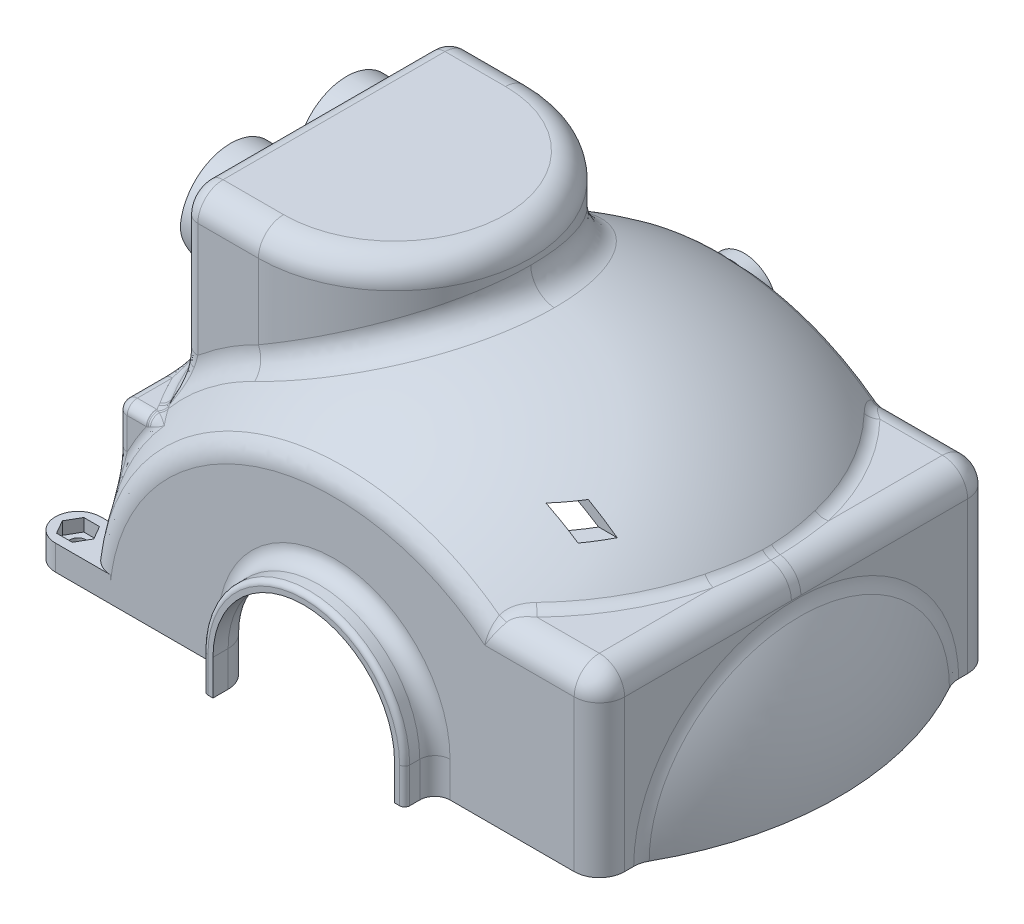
SolidWorks part; units mm, degrees
ref_plane "Plan de face" through (0, 0, 0) normal (0, 0, 1) x (1, 0, 0)
ref_plane "Plan de dessus" through (0, 0, 0) normal (0, 1, 0) x (1, 0, 0)
ref_plane "Plan de droite" through (0, 0, 0) normal (1, 0, 0) x (0, 0, -1)
sketch "Base" plane through (0, 0, 0) normal (0, 1, 0) x (1, 0, 0)
  line L0 (-52.1999, -39) -> (-25.6999, -39) construction
  line L1 (73.5868, 0) -> (-73.5868, 0) construction
  line L2 (-56.0925, -28.4341) -> (-46.1999, -20) construction
  line L3 (-19.6999, -33) -> (-19.6999, -29) construction
  line L4 (-19.6999, -29) -> (-13.8999, -29) construction
  line L5 (-9.8999, -25) -> (-9.8999, -24.5) construction
  line L6 (-9.8999, -24.5) -> (24.1001, -24.5) construction
  line L7 (24.1001, -24.5) -> (24.1001, -25) construction
  line L8 (28.1001, -29) -> (33.9001, -29) construction
  line L9 (33.9001, -29) -> (33.9001, -34) construction
  line L10 (38.9001, -39) -> (55.4001, -39) construction
  line L11 (60.4001, -34) -> (60.4001, -13.75) construction
  line L12 (57.9001, -11.25) -> (57.4001, -11.25) construction
  line L13 (57.9001, 11.25) -> (57.4001, 11.25) construction
  line L14 (60.4001, 34) -> (60.4001, 13.75) construction
  line L15 (38.9001, 39) -> (55.4001, 39) construction
  line L16 (33.9001, 29) -> (33.9001, 34) construction
  line L17 (28.1001, 29) -> (33.9001, 29) construction
  line L18 (24.1001, 24.5) -> (24.1001, 25) construction
  line L19 (-9.8999, 24.5) -> (24.1001, 24.5) construction
  line L20 (-9.8999, 25) -> (-9.8999, 24.5) construction
  line L21 (-19.6999, 29) -> (-13.8999, 29) construction
  line L22 (-19.6999, 33) -> (-19.6999, 29) construction
  line L23 (-56.0925, 28.4341) -> (-46.1999, 20) construction
  line L24 (-52.1999, 39) -> (-25.6999, 39) construction
  line L25 (57.4001, -11.25) -> (57.4001, 11.25) construction
  line L26 (-46.1999, -20) -> (-46.1999, 20) construction
  line L27 (57.4001, -66.5167) -> (57.4001, 25) construction
  line L28 (-46.1999, -66.5167) -> (-46.1999, 22.9924) construction
  line L29 (7.8001, -55.2275) -> (7.8001, 8.1549) construction
  line L30 (85.3932, 29) -> (-66.316, 29) construction
  line L31 (85.3932, -29) -> (-62.5031, -29) construction
  line L32 (39.9001, -34.5) -> (54.4001, -34.5) construction
  line L33 (-47.4499, -34.5) -> (-8.4415, -34.5) construction
  line L34 (-47.4499, 34.5) -> (-5.5388, 34.5) construction
  line L35 (-25.6999, -35.6222) -> (-25.6999, 43.8871) construction
  arc A0 (-56.0925, -28.4341) -> (-52.1999, -39) centre (-52.1999, -33) ccw construction
  arc A1 (60.4001, 13.75) -> (57.9001, 11.25) centre (57.9001, 13.75) cw construction
  arc A2 (-25.6999, -39) -> (-19.6999, -33) centre (-25.6999, -33) ccw construction
  arc A3 (-13.8999, -29) -> (-9.8999, -25) centre (-13.8999, -25) ccw construction
  arc A4 (24.1001, -25) -> (28.1001, -29) centre (28.1001, -25) ccw construction
  arc A5 (33.9001, -34) -> (38.9001, -39) centre (38.9001, -34) ccw construction
  arc A6 (55.4001, -39) -> (60.4001, -34) centre (55.4001, -34) ccw construction
  arc A7 (60.4001, -13.75) -> (57.9001, -11.25) centre (57.9001, -13.75) ccw construction
  arc A8 (38.9001, -39) -> (33.9001, -34) centre (38.9001, -34) cw construction
  arc A9 (55.4001, 39) -> (60.4001, 34) centre (55.4001, 34) cw construction
  arc A10 (24.1001, 25) -> (28.1001, 29) centre (28.1001, 25) cw construction
  arc A11 (-13.8999, 29) -> (-9.8999, 25) centre (-13.8999, 25) cw construction
  arc A12 (-25.6999, 39) -> (-19.6999, 33) centre (-25.6999, 33) cw construction
  arc A13 (-56.0925, 28.4341) -> (-52.1999, 39) centre (-52.1999, 33) cw construction
  circle A14 centre (-47.4499, -34.5) radius 1.6 construction
  circle A15 centre (-40.1999, -34.5) radius 1.6 construction
  circle A16 centre (-32.9499, -34.5) radius 1.6 construction
  circle A17 centre (-25.6999, -34.5) radius 1.6 construction
  circle A18 centre (-52.4499, -29.25) radius 1.6 construction
  circle A19 centre (-47.9499, -25.5) radius 1.6 construction
  circle A20 centre (39.9001, -34.5) radius 1.6 construction
  circle A21 centre (47.1501, -34.5) radius 1.6 construction
  circle A22 centre (54.4001, -34.5) radius 1.6 construction
  arc A23 (33.9001, 34) -> (38.9001, 39) centre (38.9001, 34) cw construction
  circle A24 centre (54.4001, 34.5) radius 1.6 construction
  circle A25 centre (47.1501, 34.5) radius 1.6 construction
  circle A26 centre (39.9001, 34.5) radius 1.6 construction
  circle A27 centre (-25.6999, 34.5) radius 1.6 construction
  circle A29 centre (-32.9499, 34.5) radius 1.6 construction
  circle A30 centre (-40.1999, 34.5) radius 1.6 construction
  circle A31 centre (-47.4499, 34.5) radius 1.6 construction
  circle A32 centre (-52.4499, 29.25) radius 1.6 construction
  circle A33 centre (-47.9499, 25.5) radius 1.6 construction
  circle A34 centre (7.8001, 0) radius 59 construction
  circle A35 centre (7.8001, 0) radius 61 construction
  dimension "D3" = 58
  dimension "D5" = 5.5
  dimension "D6" = 5
  dimension "D7" = 5.5
  dimension "D1" = 103.6
  dimension "D2" = 54
  dimension "D4" = 29
ref_plane "Plan1" through (0, 0, 0) normal (0, 0, 1) x (1, 0, 0)
sketch "Esquisse3" plane through (0, 0, 0) normal (0, 0, 1) x (1, 0, 0)
  line L0 (7.8001, -22.9267) -> (7.8001, 78.4642) construction
  line L1 (-76.3494, 0) -> (71.051, 0) construction
  line L2 (68.8001, -22.9267) -> (68.8001, 68.62) construction
  line L4 (73.5868, 0) -> (-73.5868, 0) construction
  line L5 (-76.3494, 56) -> (34.0829, 56) construction
  line L7 (7.8001, 56) -> (7.8001, 0)
  line L8 (7.8001, 0) -> (68.8001, 0)
  ellipse E0 centre (7.8001, 0) end of major axis (68.8001, 0) minor radius 56 (68.8001, 0) -> (7.8001, 56) ccw
  dimension "D1" = 61
  dimension "D2" = 56
revolve "Révolution2" add sketch "Esquisse3" angle 360 about L0
sketch "Esquisse5" plane through (0, 0, 0) normal (0, 1, 0) x (1, 0, 0)
  line L0 (7.8001, -83.8661) -> (7.8001, 13.5538) construction
  line L1 (-34.1999, -83.8661) -> (-34.1999, 57.2795) construction
  line L2 (-41.8219, -27) -> (18.8957, -27) construction
  line L3 (-82.8289, 0) -> (35.8875, 0) construction
  line L4 (73.5868, 0) -> (-73.5868, 0) construction
  line L5 (-29.1999, -73.2179) -> (-29.1999, 31.6785) construction
  line L6 (-19.1999, 27) -> (-34.1999, 27)
  line L7 (-19.1999, 37.4038) -> (-19.1999, -37.2426) construction
  line L8 (-19.1999, -27) -> (-34.1999, -27)
  line L10 (-34.1999, 27) -> (-34.1999, -27)
  arc A0 (-19.1999, -27) -> (-19.1999, 27) centre (-19.1999, 0) ccw
  dimension "D1" = 42
  dimension "D2" = 27
  dimension "D3" = 5
extrude "Boss.-Extru.2" add sketch "Esquisse5" along normal blind 67
sketch "Esquisse6" plane through (0, 0, 0) normal (0, 1, 0) x (1, 0, 0)
  line L0 (72.3863, -39) -> (30.8766, -39) construction
  line L1 (70.9993, 39) -> (29.2915, 39) construction
  line L2 (81.0853, 29) -> (16.4096, 29) construction
  line L3 (85.3932, 29) -> (-66.316, 29) construction
  line L4 (81.0853, 31) -> (16.4096, 31) construction
  line L5 (60.4001, -45.401) -> (60.4001, 49.3084) construction
  line L8 (33.9001, 39) -> (55.4089, 39)
  line L9 (33.9001, 39) -> (33.9001, -39)
  line L10 (33.9001, -39) -> (55.4089, -39)
  line L11 (60.4089, 34) -> (60.4089, -34)
  arc A0 (55.4089, 39) -> (60.4089, 34) centre (55.4089, 34) cw
  arc A1 (55.4089, -39) -> (60.4089, -34) centre (55.4089, -34) ccw
  point P26 (60.4089, -39)
  dimension "D2" = 5
  dimension "D1" = 2
extrude "Boss.-Extru.3" add sketch "Esquisse6" along normal blind 35
sketch "Esquisse7" plane through (0, 0, 0) normal (0, 1, 0) x (1, 0, 0)
  line L2 (-63.3935, -39) -> (69.5123, -39) construction
  line L3 (69.5123, -45) -> (-63.3935, -45) construction
  line L4 (7.8001, -68.0931) -> (7.8001, 0) construction
  line L6 (-12.1999, -68.0931) -> (-12.1999, -34.0884) construction
  line L7 (-12.1999, -39) -> (-12.1999, -45)
  line L8 (27.8001, -39) -> (27.8001, -45)
  line L9 (27.8001, -45) -> (-12.1999, -45)
  line L10 (27.8001, -39) -> (54.7043, -39)
  line L11 (-12.1999, -39) -> (-39.104, -39)
  line L12 (70.5045, 0) -> (-19.9845, 0) construction
  line L13 (73.5868, 0) -> (-73.5868, 0) construction
  line L14 (27.8001, 39) -> (54.7043, 39)
  line L15 (-12.1999, 39) -> (-39.104, 39)
  line L16 (27.8001, 45) -> (-12.1999, 45)
  line L17 (-12.1999, 39) -> (-12.1999, 45)
  line L18 (27.8001, 39) -> (27.8001, 45)
  arc A0 (-39.104, -39) -> (54.7043, -39) centre (7.8001, 0) ccw
  arc A1 (-39.104, 39) -> (54.7043, 39) centre (7.8001, 0) cw
  dimension "D1" = 6
  dimension "D2" = 20
extrude "Enlèv. mat.-Extru.1" cut sketch "Esquisse7" along normal blind 45
sketch "Esquisse8" plane through (0, 0, -45) normal (0, 0, -1) x (-1, 0, 0)
  line L2 (23.2692, 7) -> (-56.8001, 7) construction
  line L3 (-7.8001, -8.7668) -> (-7.8001, 31.5536) construction
  line L4 (12.1999, 7) -> (12.1999, 38.9488)
  line L5 (-27.8001, 7) -> (-27.8001, 38.9488)
  arc A0 (12.1999, 7) -> (-27.8001, 7) centre (-7.8001, 7) ccw
  arc A1 (12.1999, 38.9488) -> (-27.8001, 38.9488) centre (-7.8001, -4.9407) ccw
extrude "Enlèv. mat.-Extru.2" cut sketch "Esquisse8" against normal blind 6
mirror "Symétrie1" about plane through (0, 0, 0) normal (0, 0, 1) of "Enlèv. mat.-Extru.2"
sketch "Esquisse19" plane through (-34.1999, 0, 0) normal (-1, 0, 0) x (0, 0, 1)
  line L0 (78.7287, 0) -> (-58.759, 0) construction
  line L1 (35.6222, 0) -> (-43.8871, 0) construction
  line L2 (0, -16.6082) -> (0, 75.8696) construction
  line L3 (78.7287, 29) -> (-58.759, 29) construction
  line L4 (32, -16.6082) -> (32, 29.6307) construction
  line L5 (-32, -16.6082) -> (-32, 49.1402) construction
  line L6 (61, 0) -> (-61, 0) construction
  line L8 (-32, 0) -> (32, 0)
  line L9 (-32, 0) -> (-32, 29)
  line L10 (-32, 29) -> (32, 29)
  line L11 (32, 0) -> (32, 29)
  dimension "D1" = 29
  dimension "D2" = 32
  dimension "D3" = 32
extrude "Boss.-Extru.8" add sketch "Esquisse19" along normal blind 8
fillet "Congé1" radius 5 16 edges at (45.2654, 35, 39) (58.9444, 35, 37.5355) (60.4089, 35, 0) (58.9444, 35, -37.5355) (-26.6999, 67, 27) (7.8001, 67, 0) (-0.9948, 52.3043, 19.9393) (-0.9948, 52.3043, -19.9393) (-34.1999, 40.5381, -2.6658) (-12.1999, 38.9488, 39) (45.2654, 35, -39) (-12.1999, 38.9488, -39) (-26.6999, 67, -27) (60.4089, 28.2443, 2.6006)
fillet "Congé2" radius 3 22 edges at (-12.1999, 3.5, -39) (7.8001, 27, -39) (38.71, 32.842, -38.1137) (39.8484, 34.7752, -35.4825) (51.5186, 35, -18.8727) (55.4182, 35, 0) (38.7082, 32.8368, 38.1173) (39.5198, 34.5848, 35.9948) (27.8001, 3.5, 39) (7.8001, 27, 39) (-34.335, 32.9751, -27.6308) (-34.1999, 49.3022, -27) (-34.1999, 65.5355, -25.5355) (-34.335, 32.9751, 27.6308) (-34.1999, 49.3022, 27) (-34.1999, 65.5355, 25.5355) (27.8001, 3.5, -39) (51.5186, 35, 18.8727) (-12.1999, 3.5, 39) (-34.1999, 67, 0)
fillet "Congé4" radius 2 14 edges at (-39.47, 29, 22.1055) (-39.47, 29, -22.1055) (-42.1999, 21.9938, 25.4369) (-42.1999, 22.9269, -24.4397) (-34.683, 29, -30.3035) (-34.683, 29, 30.3035)
fillet "Congé5" radius 2 18 edges at (-42.3178, 29.446, -13.8225) (-42.3164, 11.6183, -32.5242) (-42.4798, 29.7103, 12.1175) (-42.3154, 11.6304, 32.5221) (-38.536, 29, -32) (-42.1999, 29, -25.1564) (-42.1999, 22.6448, -32) (-38.536, 29, 32) (-42.1999, 29, 25.1564) (-42.1999, 22.6448, 32) (-33.7633, 29.1251, -32.1586) (-33.7914, 29.1186, 32.1513)
shell "Coque2" thickness 2
sketch "Esquisse20" plane through (0, 0, -45) normal (0, 0, -1) x (-1, 0, 0)
  line L0 (23.3758, 7) -> (-42.1652, 7) construction
  line L1 (85.8892, 0) -> (-42.1652, 0) construction
  line L2 (53.1999, 0) -> (-68.8001, 0) construction
  line L3 (-7.8001, -6.8964) -> (-7.8001, 32.1893) construction
  line L4 (10.1999, 7) -> (10.1999, 0)
  line L5 (10.1999, 0) -> (-25.8001, 0)
  line L6 (-25.8001, 0) -> (-25.8001, 7)
  arc A0 (10.1999, 7) -> (-25.8001, 7) centre (-7.8001, 7) ccw
extrude "Enlèv. mat.-Extru.3" cut sketch "Esquisse20" against normal through all
sketch "Esquisse21" plane through (-32.1999, 0, 0) normal (1, 0, 0) x (0, 0, -1)
  line L0 (0, -13.7366) -> (0, 74.7977) construction
  line L1 (-76.8801, 0) -> (50.4995, 0) construction
  line L2 (61, 0) -> (-61, 0) construction
  line L3 (-61, 18) -> (50.4995, 18) construction
  line L4 (-76.8801, 53.5) -> (50.4995, 53.5) construction
  line L6 (-11.5, 74.7977) -> (-11.5, 46.9334) construction
  line L7 (24, 18) -> (-24, 18)
  line L8 (-30, -13.7366) -> (-30, 32.3836) construction
  line L9 (30, -13.7366) -> (30, 32.3836) construction
  line L10 (30, 12) -> (30, 0)
  line L11 (30, 0) -> (-30, 0)
  line L12 (-30, 12) -> (-30, 0)
  circle A0 centre (-11.5, 53.5) radius 8.5
  circle A1 centre (11.5, 53.5) radius 8.5
  arc A2 (-24, 18) -> (-30, 12) centre (-24, 12) ccw
  arc A3 (24, 18) -> (30, 12) centre (24, 12) cw
  point P29 (30, 18)
  dimension "D6" = 6
  dimension "D1" = 18
  dimension "D2" = 30
  dimension "D3" = 30
  dimension "D4" = 11.5
  dimension "D5" = 53.5
extrude "Enlèv. mat.-Extru.4" cut sketch "Esquisse21" against normal blind 25
sketch "Esquisse22" plane through (0, 0, 0) normal (0, -1, 0) x (1, 0, 0)
  line L0 (-47.4499, -44.1193) -> (-47.4499, -28.5567) construction
  line L1 (-47.4499, -30) -> (-43.0034, -30)
  line L2 (-47.4499, -39) -> (-36.4718, -39)
  line L4 (-84.7755, 0) -> (-14.3065, 0) construction
  line L5 (73.5868, 0) -> (-73.5868, 0) construction
  line L6 (-47.4499, 30) -> (-43.0034, 30)
  line L7 (-47.4499, 39) -> (-36.4718, 39)
  line L8 (64.6856, -31) -> (47.2845, -31) construction
  line L9 (50.9001, -41.1101) -> (50.9001, -30) construction
  line L10 (61.7991, -37) -> (46.1712, -37) construction
  line L11 (37.7057, -37) -> (55.4089, -37) construction
  line L12 (54.4001, -31) -> (58.5136, -31)
  line L13 (55.4089, -37) -> (50.9001, -37)
  line L14 (50.9001, -37) -> (50.9001, -34.5)
  line L15 (54.4001, 31) -> (58.5136, 31)
  line L16 (58.4089, -34) -> (58.4089, -32.2061)
  line L18 (55.4089, 37) -> (50.9001, 37)
  line L19 (50.9001, 37) -> (50.9001, 34.5)
  line L20 (58.4089, 34) -> (58.4089, 32.2061)
  circle A0 centre (-47.4499, -34.5) radius 1.6
  arc A1 (-47.4499, -30) -> (-47.4499, -39) centre (-47.4499, -34.5) ccw
  arc A2 (-43.0034, -30) -> (-36.4718, -39) centre (7.8001, 0) ccw
  circle A3 centre (-47.4499, 34.5) radius 1.6
  arc A4 (-47.4499, 30) -> (-47.4499, 39) centre (-47.4499, 34.5) cw
  arc A5 (-43.0034, 30) -> (-36.4718, 39) centre (7.8001, 0) cw
  circle A6 centre (54.4001, -34.5) radius 1.25
  arc A7 (55.4089, -37) -> (58.4089, -34) centre (55.4089, -34) ccw
  arc A8 (50.9001, -34.5) -> (54.4001, -31) centre (54.4001, -34.5) cw
  arc A9 (58.5136, -31) -> (58.4089, -32.2061) centre (65.4089, -32.2061) ccw
  circle A10 centre (54.4001, 34.5) radius 1.25
  arc A11 (55.4089, 37) -> (58.4089, 34) centre (55.4089, 34) cw
  arc A12 (50.9001, 34.5) -> (54.4001, 31) centre (54.4001, 34.5) ccw
  arc A13 (58.5136, 31) -> (58.4089, 32.2061) centre (65.4089, 32.2061) cw
  point P44 (50.9001, -31)
  dimension "D2" = 3.5
extrude "Boss.-Extru.9" add sketch "Esquisse22" against normal blind 5
sketch "Esquisse23" plane through (-34.1999, 0, 0) normal (-1, 0, 0) x (0, 0, 1)
  line L0 (11.5, 75.5937) -> (11.5, 53.5) construction
  line L1 (11.5, 53.5) -> (35.0051, 39.9293) construction
  line L2 (0, 74.6225) -> (0, 34.6542) construction
  line L3 (18.8612, 49.25) -> (20.1603, 48.5)
  line L4 (4.1388, 49.25) -> (2.8397, 48.5)
  line L5 (-4.1388, 49.25) -> (-2.8397, 48.5)
  line L6 (-18.8612, 49.25) -> (-20.1603, 48.5)
  arc A0 (18.8612, 49.25) -> (4.1388, 49.25) centre (11.5, 53.5) ccw
  arc A1 (20.1603, 48.5) -> (2.8397, 48.5) centre (11.5, 53.5) ccw
  arc A2 (-20.1603, 48.5) -> (-2.8397, 48.5) centre (-11.5, 53.5) cw
  arc A3 (-18.8612, 49.25) -> (-4.1388, 49.25) centre (-11.5, 53.5) cw
  dimension "D1" = 120
extrude "Boss.-Extru.10" add sketch "Esquisse23" along normal blind 6
fillet "Congé6" radius 6 4 edges at (-40.1999, 48.875, 19.5107) (-40.1999, 48.875, 3.4893) (-40.1999, 48.875, -3.4893) (-40.1999, 48.875, -19.5107)
sketch "Esquisse24" plane through (0, 0, -39) normal (0, 0, -1) x (-1, 0, 0)
  circle A0 centre (-10.6001, 38) radius 5.5
extrude "Enlèv. mat.-Extru.5" cut sketch "Esquisse24" against normal blind 5
fillet "Congé7" radius 1 6 edges at (27.8001, 3.5, 45) (-12.1999, 3.5, 45) (27.8001, 3.5, -45) (-12.1999, 3.5, -45) (7.8001, 27, 45) (7.8001, 27, -45)
sketch "Esquisse25" plane through (0, 5, 0) normal (0, 1, 0) x (1, 0, 0)
  line L1 (-44.3322, 34.5) -> (-45.891, 37.2)
  line L2 (-45.891, 37.2) -> (-49.0087, 37.2)
  line L3 (-49.0087, 37.2) -> (-50.5676, 34.5)
  line L4 (-50.5676, 34.5) -> (-49.0087, 31.8)
  line L5 (-49.0087, 31.8) -> (-45.891, 31.8)
  line L6 (-45.891, 31.8) -> (-44.3322, 34.5)
  line L7 (-44.3322, -34.5) -> (-45.891, -31.8)
  line L8 (-45.891, -31.8) -> (-49.0087, -31.8)
  line L9 (-49.0087, -31.8) -> (-50.5676, -34.5)
  line L10 (-50.5676, -34.5) -> (-49.0087, -37.2)
  line L11 (-49.0087, -37.2) -> (-45.891, -37.2)
  line L12 (-45.891, -37.2) -> (-44.3322, -34.5)
  circle A0 centre (-47.4499, 34.5) radius 2.7 construction
  circle A1 centre (-47.4499, -34.5) radius 2.7 construction
extrude "Enlèv. mat.-Extru.6" cut sketch "Esquisse25" against normal blind 2.5
sketch "Esquisse26" plane through (0, 0, -37) normal (0, 0, -1) x (-1, 0, 0)
  circle A0 centre (-10.6001, 38) radius 5.5
  circle A1 centre (-10.6001, 38) radius 6.5374
  spline S0 degree 3 poles (-38.491, 34.541) (-37.6429, 35.1796) (-36.7742, 35.7894) (-35.0106, 36.9438) (-34.1139, 37.4899) (-31.3808, 39.0378) (-29.5014, 39.9497) (-25.6312, 41.5404) (-23.6387, 42.2196) (-19.5467, 43.3373) (-17.4875, 43.7651) (-13.344, 44.3717) (-11.2596, 44.5505) (-8.1143, 44.6319) (-7.0627, 44.6278) (-4.9532, 44.5559) (-3.892, 44.4878) (-0.7374, 44.1892) (1.3356, 43.8656) (5.4228, 42.9741) (7.437, 42.4062) (10.4127, 41.3654) (11.397, 40.9869) (13.3497, 40.1643) (14.3151, 39.7214) (16.213, 38.7764) (17.1491, 38.2725) (18.9776, 37.2107) (19.8711, 36.6526) (22.4893, 34.8967) (24.1521, 33.618) (26.5179, 31.5319) (27.285, 30.8085) (28.4023, 29.6796) (28.7697, 29.2954) (29.4884, 28.5171) (29.8401, 28.1227) (31.5608, 26.1244) (32.8164, 24.442) (34.5151, 21.7904) (35.0505, 20.8852) (35.8058, 19.4942) (36.0496, 19.0251) (36.5209, 18.0754) (36.7485, 17.5947) (37.8363, 15.1818) (38.5547, 13.2073) (39.6899, 9.1706) (40.1068, 7.1084) (40.3649, 5) knots 0 0 0 0 0.03125 0.03125 0.0625 0.0625 0.125 0.125 0.1875 0.1875 0.25 0.25 0.3125 0.3125 0.34375 0.34375 0.375 0.375 0.4375 0.4375 0.5 0.5 0.53125 0.53125 0.5625 0.5625 0.59375 0.59375 0.625 0.625 0.6875 0.6875 0.71875 0.71875 0.734375 0.734375 0.75 0.75 0.8125 0.8125 0.84375 0.84375 0.859375 0.859375 0.875 0.875 0.9375 0.9375 1 1 1 1 construction
extrude "Boss.-Extru.11" add sketch "Esquisse26" along normal blind 2.5
ref_plane "Plan2" through (0, 0, 19) normal (0, 0, 1) x (1, 0, 0)
sketch "Esquisse27" plane through (0, 0, 19) normal (0, 0, 1) x (1, 0, 0)
  line L0 (60.4089, 59.6671) -> (60.4089, -20.9724) construction
  line L1 (0.0389, 45) -> (0.0389, -20.9724) construction
  line L2 (88.7262, 0) -> (-34.5255, 0) construction
  line L3 (68.8001, 0) -> (-53.1999, 0) construction
  line L4 (88.7262, 44) -> (-24.4119, 44) construction
  line L5 (81.1747, 41) -> (-24.4119, 41) construction
  line L6 (3.5389, 57.909) -> (3.5389, 38.6704) construction
  line L7 (6.5389, 45.0909) -> (6.5389, 38.6704) construction
  line L8 (9.5389, 45.0909) -> (9.5389, 38.6704) construction
  line L9 (-2.2619, 45) -> (26.2476, 45) construction
  line L10 (-2.2619, 45.3) -> (38.2671, 45.3) construction
  line L12 (16.1089, 45.3) -> (35.0865, 45.3)
  line L13 (16.1089, 67.7154) -> (16.1089, 3.9155) construction
  line L14 (16.1089, 45.3) -> (16.1089, 51.1756)
  spline S0 degree 3 poles (16.1089, 51.1756) (26.0994, 49.8198) (33.374, 46.151) (35.0865, 45.3) knots 0.252148 0.252148 0.252148 0.252148 1 1 1 1
  dimension "D1" = 60.37
  dimension "D2" = 41
  dimension "D3" = 44
  dimension "D4" = 3
  dimension "D5" = 3
  dimension "D6" = 3.5
  dimension "D7" = 1
  dimension "D8" = 0.3
  dimension "D9" = 44.3
extrude "Boss.-Extru.12" add sketch "Esquisse27" along normal blind 3
sketch "Esquisse29" plane through (16.1089, 0, 0) normal (-1, 0, 0) x (0, 0, 1)
  line L0 (19, 39.0468) -> (19, 55.6831) construction
  line L1 (23.8, 55.6831) -> (23.8, 41.1925) construction
  line L2 (25.8, 55.6831) -> (25.8, 39.0468) construction
  line L3 (17.9446, 45.3) -> (24.2177, 45.3) construction
  line L4 (19, 50.5538) -> (19, 45.3) construction
  line L5 (26.2829, 41.6) -> (18.8386, 41.6) construction
  line L6 (26.2829, 39.6) -> (18.8386, 39.6) construction
  line L7 (20.5, 47.0069) -> (20.5, 43.001) construction
  line L8 (23.8, 45.3) -> (22, 45.3)
  line L9 (22, 45.3) -> (22, 49.524) construction
  line L10 (22, 45.3) -> (22, 50.3135)
  line L11 (25.8, 48.5395) -> (22, 50.3135)
  line L12 (25.8, 48.5395) -> (25.8, 40.6)
  line L13 (24.8, 39.6) -> (19, 39.6)
  line L14 (19, 39.6) -> (19, 41.6)
  line L15 (19, 41.6) -> (23.8, 41.6)
  line L16 (23.8, 41.6) -> (23.8, 45.3)
  arc A0 (25.8, 40.6) -> (24.8, 39.6) centre (24.8, 40.6) cw
  point P28 (25.8, 39.6)
  dimension "D5" = 1
  dimension "D1" = 2
  dimension "D2" = 3.3
  dimension "D3" = 2
  dimension "D4" = 3.7
extrude "Boss.-Extru.13" add sketch "Esquisse29" against normal blind 5
fillet "Congé8" radius 1 5 edges at (16.1089, 49.524, 22)
sketch "Esquisse30" plane through (16.1089, 0, 0) normal (-1, 0, 0) x (0, 0, 1)
  line L1 (23.8, 45.3) -> (19, 45.3) construction
  line L2 (19, 45.3) -> (23.8, 45.3)
  line L3 (19, 45.3) -> (19, 41.6)
  line L4 (19, 41.6) -> (23.8, 41.6)
  line L5 (23.8, 45.3) -> (23.8, 41.6)
  line L6 (18.2909, 45.3) -> (23.3716, 45.3) construction
  line L8 (23.8, 41.6) -> (19, 41.6) construction
  line L9 (23.8, 45.3) -> (23.8, 41.6) construction
extrude "Enlèv. mat.-Extru.7" cut sketch "Esquisse30" against normal through all
